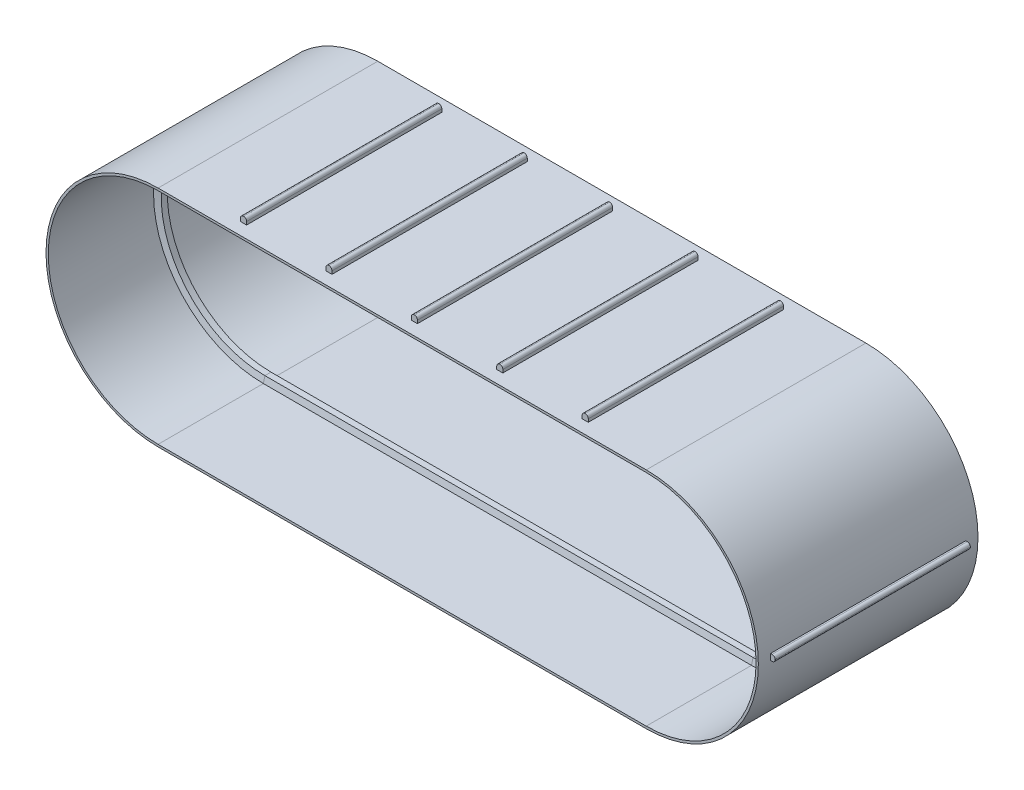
SolidWorks part; units mm, degrees
ref_plane "Front Plane" through (0, 0, 0) normal (0, 0, 1) x (1, 0, 0)
ref_plane "Top Plane" through (0, 0, 0) normal (0, 1, 0) x (1, 0, 0)
ref_plane "Right Plane" through (0, 0, 0) normal (1, 0, 0) x (0, 0, -1)
sketch "Sketch1" plane through (0, 0, 0) normal (0, 0, 1) x (1, 0, 0)
  line L0 (-508, 228.6) -> (508, 228.6)
  line L1 (-508, -228.6) -> (508, -228.6)
  line L2 (-508, -233.3498) -> (508, -233.3498)
  line L3 (-508, 233.3498) -> (508, 233.3498)
  arc A0 (-508, 228.6) -> (-508, -228.6) centre (-508, 0) ccw
  arc A1 (508, -228.6) -> (508, 228.6) centre (508, 0) ccw
  arc A2 (-508, 233.3498) -> (-508, -233.3498) centre (-508, 0) ccw
  arc A3 (508, -233.3498) -> (508, 233.3498) centre (508, 0) ccw
  dimension "D3" = 457.2
  dimension "D4" = 457.2
  dimension "D1" = 508
  dimension "D2" = 508
  dimension "D5" = 4.7498
extrude "Extrude1" add sketch "Sketch1" along normal mid plane 457.2
sketch "Sketch7" plane through (0, 0, 0) normal (1, 0, 0) x (0, 0, -1)
  line L0 (9.525, -228.6) -> (6.35, -215.9)
  line L1 (-228.6, -228.6) -> (228.6, -228.6) construction
  line L2 (6.35, -215.9) -> (-6.35, -215.9)
  line L3 (-6.35, -215.9) -> (-9.525, -228.6)
  line L4 (-9.525, -228.6) -> (9.525, -228.6)
  dimension "D1" = 12.7
  dimension "D2" = 19.05
  dimension "D3" = 12.7
  dimension "D4" = 9.525
  dimension "D5" = 6.35
sketch "Sketch8" plane through (0, 0, 0) normal (0, 0, 1) x (1, 0, 0)
  line L0 (508, 228.6) -> (-508, 228.6)
  line L1 (-508, -228.6) -> (508, -228.6)
  arc A0 (-508, 228.6) -> (-508, -228.6) centre (-508, 0) ccw
  arc A1 (508, -228.6) -> (508, 228.6) centre (508, 0) ccw
  dimension "D1" = 457.2
  dimension "D2" = 508
  dimension "D3" = 508
sweep "Sweep1" add profiles "Sketch7" path "Sketch8"
sketch "Sketch20" plane through (0, 233.3498, 0) normal (0, 1, 0) x (-1, 0, 0)
  line L4 (-6.35, 203.2) -> (6.35, 203.2)
  line L5 (-6.35, 203.2) -> (-6.35, -203.2)
  line L6 (-6.35, -203.2) -> (6.35, -203.2)
  line L7 (6.35, 203.2) -> (6.35, -203.2)
  dimension "D1" = 406.4
  dimension "D2" = 12.7
  dimension "D3" = 6.35
  dimension "D4" = 203.2
extrude "Extrude3" add sketch "Sketch20" along normal blind 12.7
fillet "Fillet1" radius 6.35 1 edges at (6.35, 246.0498, 0)
fillet "Fillet2" radius 6.35 1 edges at (-6.35, 246.0498, 0)
sketch "Sketch21" plane through (0, 0, 0) normal (0, 0, 1) x (1, 0, 0)
  line L0 (507.9971, 233.3625) -> (-508, 233.3498)
  line L1 (-510.4346, -233.3498) -> (508, -233.3498)
  arc A0 (-505.5683, 233.3498) -> (-505.5654, -233.3498) centre (-508, 0) ccw
  arc A1 (505.5654, -233.3498) -> (507.9971, 233.3625) centre (508, 0) ccw
  dimension "D1" = 466.725
  dimension "D2" = 508
  dimension "D3" = 508
pattern_linear "LPattern2" count 3 spacing 177.8 along (-1, 0, 0) of "Extrude3", "Fillet1", "Fillet2"
pattern_linear "LPattern6" count 3 spacing 177.8 along (1, 0, 0) of "Extrude3", "Fillet1", "Fillet2"
mirror "Mirror1" about plane through (0, 0, 0) normal (0, 1, 0) of "Extrude3", "Fillet1", "Fillet2", "LPattern2", "LPattern6"
ref_plane "Plane1" through (741.3498, 0, 0) normal (1, 0, 0) x (0, 0, -1)
sketch "Sketch22" plane through (741.3498, 0, 0) normal (1, 0, 0) x (0, 0, -1)
  line L1 (203.2, -6.35) -> (-203.2, -6.35)
  line L2 (203.2, -6.35) -> (203.2, 6.35)
  line L3 (203.2, 6.35) -> (-203.2, 6.35)
  line L4 (-203.2, -6.35) -> (-203.2, 6.35)
  dimension "D1" = 12.7
  dimension "D2" = 6.35
  dimension "D3" = 406.4
  dimension "D4" = 203.2
extrude "Extrude4" add sketch "Sketch22" along normal blind 9.5758
fillet "Fillet3" radius 6.35 1 edges at (750.9256, -6.35, 0)
fillet "Fillet4" radius 6.35 1 edges at (750.9256, 6.35, 0)
